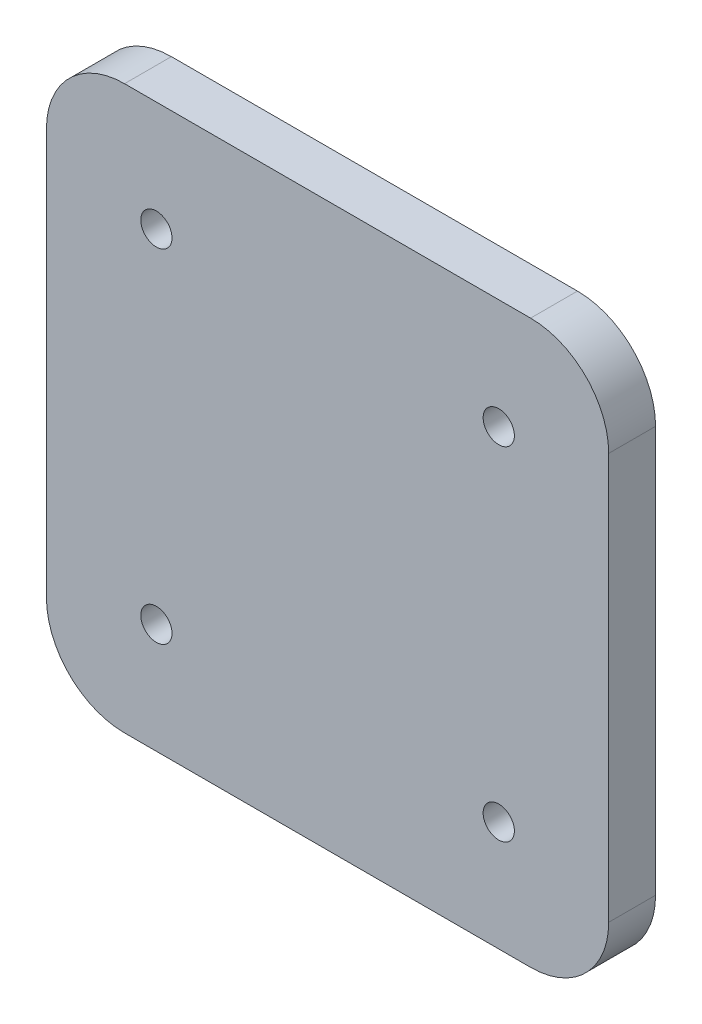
SolidWorks part; units mm, degrees
ref_plane "Спереди" through (0, 0, 0) normal (0, 0, 1) x (1, 0, 0)
ref_plane "Сверху" through (0, 0, 0) normal (0, 1, 0) x (1, 0, 0)
ref_plane "Справа" through (0, 0, 0) normal (1, 0, 0) x (0, 0, -1)
sketch "Эскиз1" plane through (0, 0, 0) normal (0, 0, 1) x (1, 0, 0)
  line L0 (-10.9602, 10.9602) -> (10.9602, 10.9602) construction
  line L1 (-13, 18) -> (13, 18)
  line L2 (-18, 13) -> (-18, -13)
  line L3 (-13, -18) -> (13, -18)
  line L4 (18, 13) -> (18, -13)
  line L5 (-18, 18) -> (18, -18) construction
  line L6 (-18, -18) -> (18, 18) construction
  line L7 (10.9602, 10.9602) -> (10.9602, -10.9602) construction
  line L8 (10.9602, -10.9602) -> (-10.9602, -10.9602) construction
  line L9 (-10.9602, -10.9602) -> (-10.9602, 10.9602) construction
  circle A0 centre (10.9602, 10.9602) radius 1
  circle A1 centre (10.9602, -10.9602) radius 1
  circle A2 centre (-10.9602, -10.9602) radius 1
  circle A3 centre (-10.9602, 10.9602) radius 1
  arc A4 (-13, 18) -> (-18, 13) centre (-13, 13) ccw
  arc A5 (-18, -13) -> (-13, -18) centre (-13, -13) ccw
  arc A6 (13, -18) -> (18, -13) centre (13, -13) ccw
  arc A7 (18, 13) -> (13, 18) centre (13, 13) ccw
  point P0 (0, 0)
  dimension "D4" = 2
  dimension "D5" = 2
  dimension "D6" = 2
  dimension "D7" = 2
  dimension "D8" = 5
  dimension "D1" = 36
  dimension "D2" = 36
  dimension "D3" = 15.5
extrude "Бобышка-Вытянуть1" add sketch "Эскиз1" along normal blind 3
